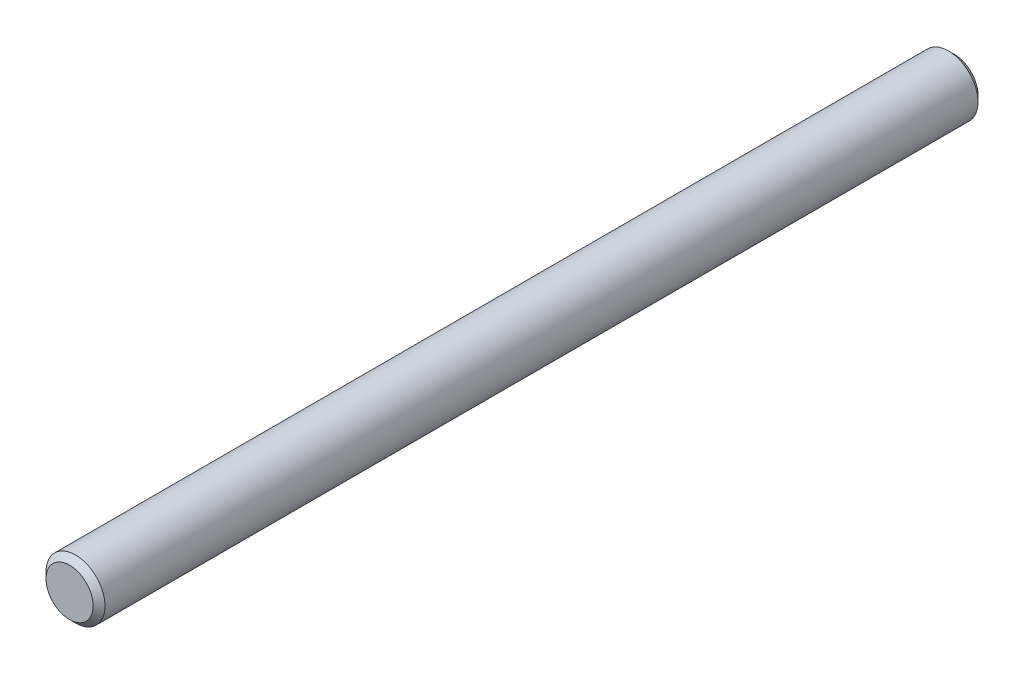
SolidWorks part; units mm, degrees
ref_plane "Plan de face" through (0, 0, 0) normal (0, 0, 1) x (1, 0, 0)
ref_plane "Plan de dessus" through (0, 0, 0) normal (0, 1, 0) x (1, 0, 0)
ref_plane "Plan de droite" through (0, 0, 0) normal (1, 0, 0) x (0, 0, -1)
sketch "Esquisse1" plane through (0, 0, 0) normal (0, 0, 1) x (1, 0, 0)
  circle A0 centre (0, 0) radius 1
  dimension "D1" = 2
extrude "Boss.-Extru.1" add sketch "Esquisse1" along normal blind 30
chamfer "Chanfrein1" distance 0.2 angle 45 2 edges at (1, 0, 0) (1, 0, 30)
